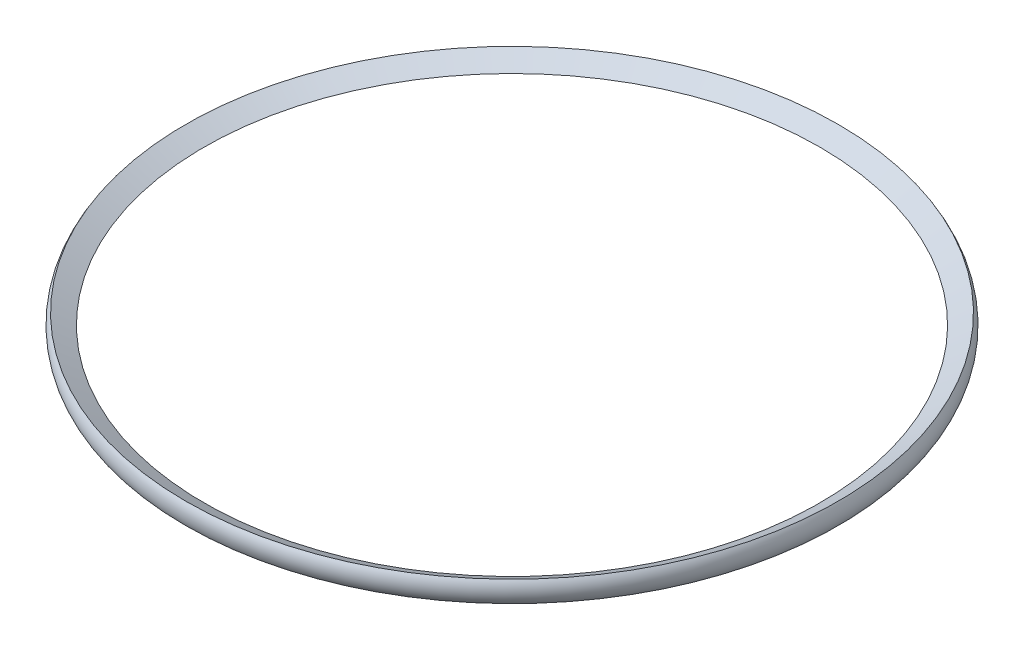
SolidWorks part; units mm, degrees
ref_plane "Front Plane" through (0, 0, 0) normal (0, 0, 1) x (1, 0, 0)
ref_plane "Top Plane" through (0, 0, 0) normal (0, 1, 0) x (1, 0, 0)
ref_plane "Right Plane" through (0, 0, 0) normal (1, 0, 0) x (0, 0, -1)
sketch "Sketch1" plane through (0, 0, 0) normal (0, 0, 1) x (1, 0, 0)
  line L0 (0, 0) -> (0, 76.0261) construction
  line L1 (-103.3907, 0.1452) -> (-109.5375, 3.6941)
  line L3 (-109.5375, -3.4036) -> (-103.3907, 0.1452)
  line L4 (-103.3907, 0.1452) -> (-110.6218, 0.1452) construction
  arc A0 (-109.5375, 3.6941) -> (-109.5375, -3.4036) centre (-104.2718, 0.1452) ccw
  dimension "D1" = 6.35
revolve "Revolve1" add sketch "Sketch1" angle 360 about L0
